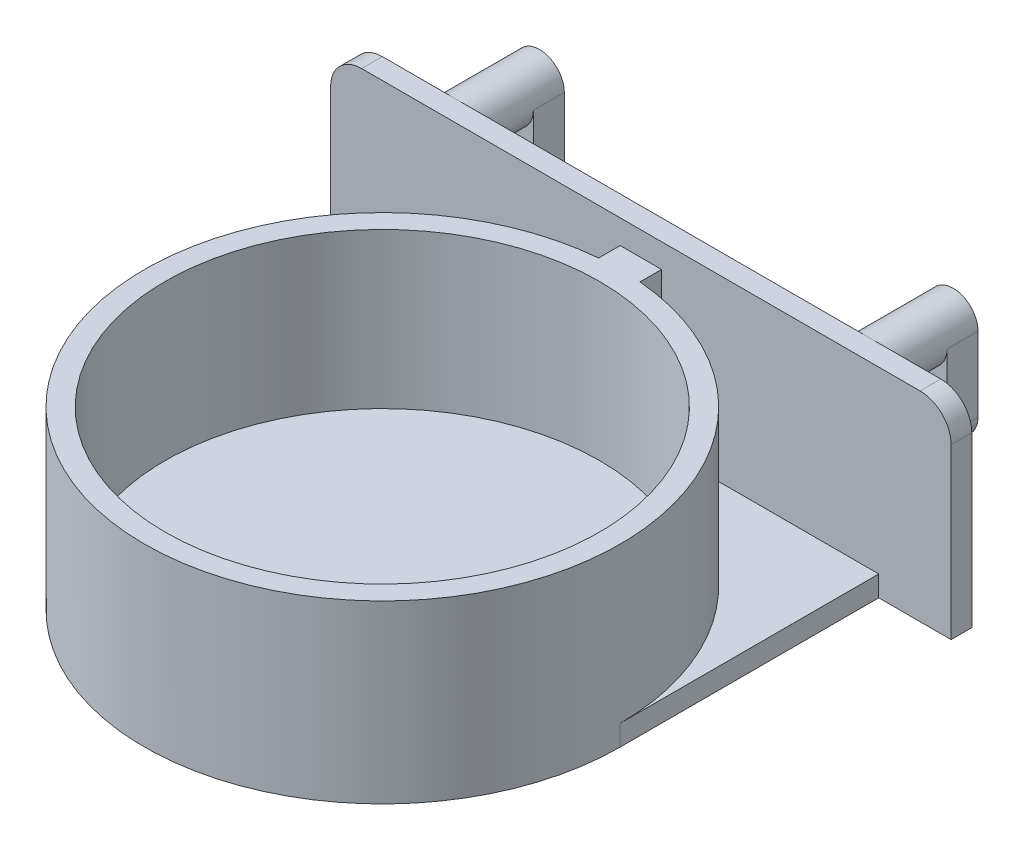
SolidWorks part; units mm, degrees
ref_plane "Ön Düzlem" through (0, 0, 0) normal (0, 0, 1) x (1, 0, 0)
ref_plane "Üst Düzlem" through (0, 0, 0) normal (0, 1, 0) x (1, 0, 0)
ref_plane "Sağ Düzlem" through (0, 0, 0) normal (1, 0, 0) x (0, 0, -1)
sketch "Çizim1" plane through (0, 0, 0) normal (0, 1, 0) x (1, 0, 0)
  circle A0 centre (0, 0) radius 21
  circle A1 centre (0, 0) radius 23
  dimension "D1" = 42
  dimension "D2" = 2
extrude "Yükseklik-Ekstrüzyon1" add sketch "Çizim1" along normal blind 15
sketch "Çizim2" plane through (0, 0, 0) normal (0, -1, 0) x (1, 0, 0)
  line L0 (-23, 0) -> (-23, -25)
  line L1 (23, 0) -> (23, -25)
  line L2 (23, -25) -> (-23, -25)
  circle A1 centre (0, 0) radius 23
  arc A2 (23, 0) -> (-23, 0) centre (0, 0) ccw
  dimension "D2" = 25
  dimension "D1" = 0
extrude "Yükseklik-Ekstrüzyon2" add sketch "Çizim2" along normal blind 2
sketch "Çizim3" plane through (0, 0, -25) normal (0, 0, -1) x (-1, 0, 0)
  line L0 (23, -2) -> (-23, -2) construction
  line L2 (30, -2) -> (30, 14.3251)
  line L3 (27, 17.3251) -> (-27, 17.3251)
  line L4 (-30, -2) -> (-30, 14.3251)
  line L5 (0, -2) -> (-30, 17.3251) construction
  line L6 (30, 17.3251) -> (0, -2) construction
  line L7 (-30, -2) -> (30, -2)
  arc A0 (30, 14.3251) -> (27, 17.3251) centre (27, 14.3251) ccw
  arc A1 (-27, 17.3251) -> (-30, 14.3251) centre (-27, 14.3251) ccw
  point P0 (0, -2)
  dimension "D2" = 3
  dimension "D1" = 60
extrude "Yükseklik-Ekstrüzyon3" add sketch "Çizim3" along normal blind 2
sketch "Çizim4" plane through (0, 15, 0) normal (0, 1, 0) x (1, 0, 0)
  line L0 (0, 21.8) -> (0, 27) construction
  line L1 (-27, 27) -> (27, 27) construction
  line L2 (-2, 21.8) -> (-2, 26.8)
  line L3 (2, 21.8) -> (2, 26.8)
  line L4 (-2, 26.8) -> (2, 26.8)
  line L5 (-2, 21.8) -> (2, 21.8)
  point P8 (0, 24)
  dimension "D1" = 4
  dimension "D2" = 5
  dimension "D3" = 5.2
extrude "Yükseklik-Ekstrüzyon4" add sketch "Çizim4" against normal up to surface (15 mm away)
sketch "Çizim5" plane through (0, 0, -27) normal (0, 0, -1) x (-1, 0, 0)
  line L0 (27, 17.3251) -> (-27, 17.3251) construction
  circle A0 centre (-20, 14.9251) radius 2.4
  dimension "D1" = 20
  dimension "D2" = 4.8
extrude "Yükseklik-Ekstrüzyon5" add sketch "Çizim5" along normal blind 5.2
sketch "Çizim6" plane through (0, 0, -32.2) normal (0, 0, -1) x (-1, 0, 0)
  line L0 (-20, 14.9251) -> (-20, 7.7251) construction
  line L1 (-17.6, 14.9251) -> (-17.6, 7.7251)
  line L2 (-22.4, 14.9251) -> (-22.4, 7.7251)
  arc A0 (-17.6, 14.9251) -> (-22.4, 14.9251) centre (-20, 14.9251) ccw
  arc A1 (-22.4, 7.7251) -> (-17.6, 7.7251) centre (-20, 7.7251) ccw
  point P3 (-20, 11.3251)
  point P8 (-20, 5.3251)
  dimension "D1" = 2.4
  dimension "D2" = 12
extrude "Yükseklik-Ekstrüzyon6" add sketch "Çizim6" along normal blind 3
ref_plane "Düzlem1" through (0, 0, 0) normal (1, 0, 0) x (0, 0, -1)
mirror "Aynalama1" about plane through (0, 0, 0) normal (1, 0, 0) of "Yükseklik-Ekstrüzyon6", "Yükseklik-Ekstrüzyon5"
